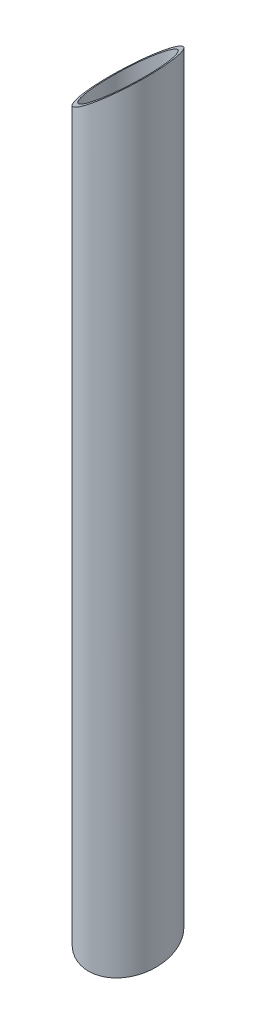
SolidWorks part; units mm, degrees
ref_plane "Vorne" through (0, 0, 0) normal (0, 0, 1) x (1, 0, 0)
ref_plane "Oben" through (0, 0, 0) normal (0, 1, 0) x (1, 0, 0)
ref_plane "Rechts" through (0, 0, 0) normal (1, 0, 0) x (0, 0, -1)
sketch "Skizze1" plane through (0, 0, 0) normal (0, 1, 0) x (1, 0, 0)
  circle A0 centre (0, 0) radius 15
  dimension "D1" = 30
extrude "Linear-Austragen-Dünn1" add sketch "Skizze1" along normal blind 400 thin
sketch "Skizze5" plane through (0, 0, 0) normal (0, 0, -1) x (-1, 0, 0)
  line L0 (-15, 0) -> (-46.4505, 86.4095)
  line L2 (-15, 0) -> (69.0443, 30.5896)
  line L3 (-15, 400) -> (-15, 0) construction
  dimension "D1" = 20
sketch "Skizze6" plane through (0, 0, 0) normal (1, 0, 0) x (0, 0, -1)
  line L0 (15, 8.0385) -> (-15, 0) construction
  line L1 (15, 8.0385) -> (-15, 0)
extrude "Schnitt-Linear austragen1" cut sketch "Skizze6" against normal through all and the other way through all
sketch "Skizze8" plane through (0, 0, 0) normal (0, 0, 1) x (1, 0, 0)
  line L1 (-15, 400) -> (15, 400)
  line L2 (-15, 400) -> (-15, 0)
  line L3 (-15, 0) -> (15, 0)
  line L4 (15, 400) -> (15, 0)
ref_plane "Ebene1" through (0, 0, 0) normal (0.1352, 0, 0.9908) x (0.9908, 0, -0.1352)
sketch "Skizze10" plane through (0, 0, 0) normal (0.1352, 0, 0.9908) x (0.9908, 0, -0.1352)
  line L0 (43.6712, 321.1885) -> (-39.9094, 254.9231)
  line L2 (-39.9094, 254.9231) -> (-39.9094, 417.9004)
  line L3 (-39.9094, 417.9004) -> (43.6712, 417.9004)
  line L4 (43.6712, 417.9004) -> (43.6712, 321.1885)
  dimension "D1" = 43.6712
  dimension "D2" = 39.9094
  dimension "D3" = 254.9231
  dimension "D4" = 321.1885
  dimension "D5" = 417.9004
extrude "Schnitt-Linear austragen2" cut sketch "Skizze10" against normal through all and the other way through all
